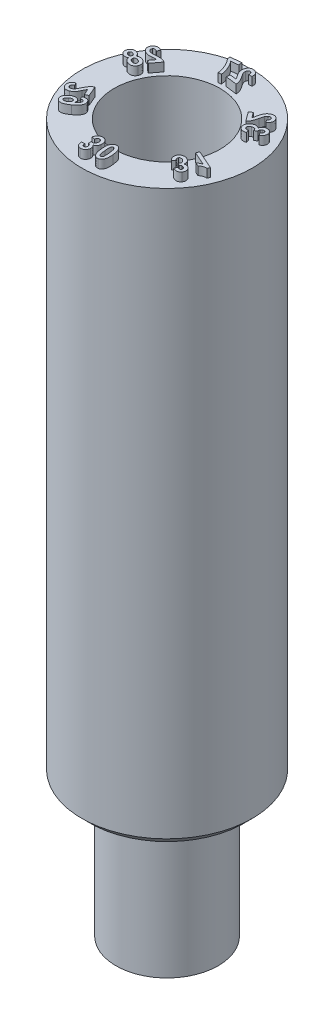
SolidWorks part; units mm, degrees
other "<M3L8-SetScrew>-<Chamfer1>" parameters "D10"=0.24
ref_plane "Front Plane" through (0, 0, 0) normal (0, 0, 1) x (1, 0, 0)
ref_plane "Top Plane" through (0, 0, 0) normal (0, 1, 0) x (1, 0, 0)
ref_plane "Right Plane" through (0, 0, 0) normal (1, 0, 0) x (0, 0, -1)
sketch "Sketch1" plane through (0, 0, 0) normal (0, 0, 1) x (1, 0, 0)
  line L0 (0, 0) -> (0, 20) construction
  line L1 (0, -2.75) -> (0, 2.75) construction
  line L2 (1.5, -16.75) -> (2.26, -16.75)
  line L4 (2.5, -16.51) -> (2.5, 0)
  line L5 (2.5, 0) -> (1.55, 0)
  line L6 (1.55, 0) -> (1.55, -2.8)
  line L7 (1.55, -2.8) -> (0.8, -2.8)
  line L8 (0.8, -2.8) -> (0.8, -12.75)
  line L9 (0.8, -12.75) -> (1.5, -12.75)
  line L10 (1.5, -12.75) -> (1.5, -16.75)
  line L11 (2.26, -16.75) -> (2.5, -16.51)
  point P6 (2.5, -16.75)
  dimension "D1" = 2.8
  dimension "D2" = 4
  dimension "D3" = 1.6
  dimension "D4" = 3.1
  dimension "D5" = 5
  dimension "D6" = 3
  dimension "D7" = 16.75
revolve "Revolve1" add sketch "Sketch1" angle 360 about L0
sketch "Sketch2" plane through (0, 0, 0) normal (0, 1, 0) x (1, 0, 0)
  line L0 (0, 0) -> (0, 2.1482) construction
  line L1 (0, 0) -> (1.8604, 1.0741) construction
  line L2 (0, 0) -> (1.8604, -1.0741) construction
  line L3 (0, 0) -> (0, -2.1482) construction
  line L4 (0, 0) -> (-1.8604, -1.0741) construction
  line L5 (0, 0) -> (-1.8604, 1.0741) construction
  arc A0 (0.3947, 1.6433) -> (1.0831, 1.2973) centre (0, 0) ccw construction
  text T0 "27     28     29     30     31     32" font "Arial Narrow" height 0.6
  point P12 (0, 0)
  point P17 (0, 0)
  point P18 (0, 0)
  point P21 (0, 0)
  dimension "D1" = 3.38
  dimension "D2" = 6
extrude "Boss-Extrude1" add sketch "Sketch2" along normal blind 0.25
inserted part "M3L8-SetScrew"
move or copy body "Body-Move/Copy2" placed by mates yes
other "Distance1" parameters "D1"=4
